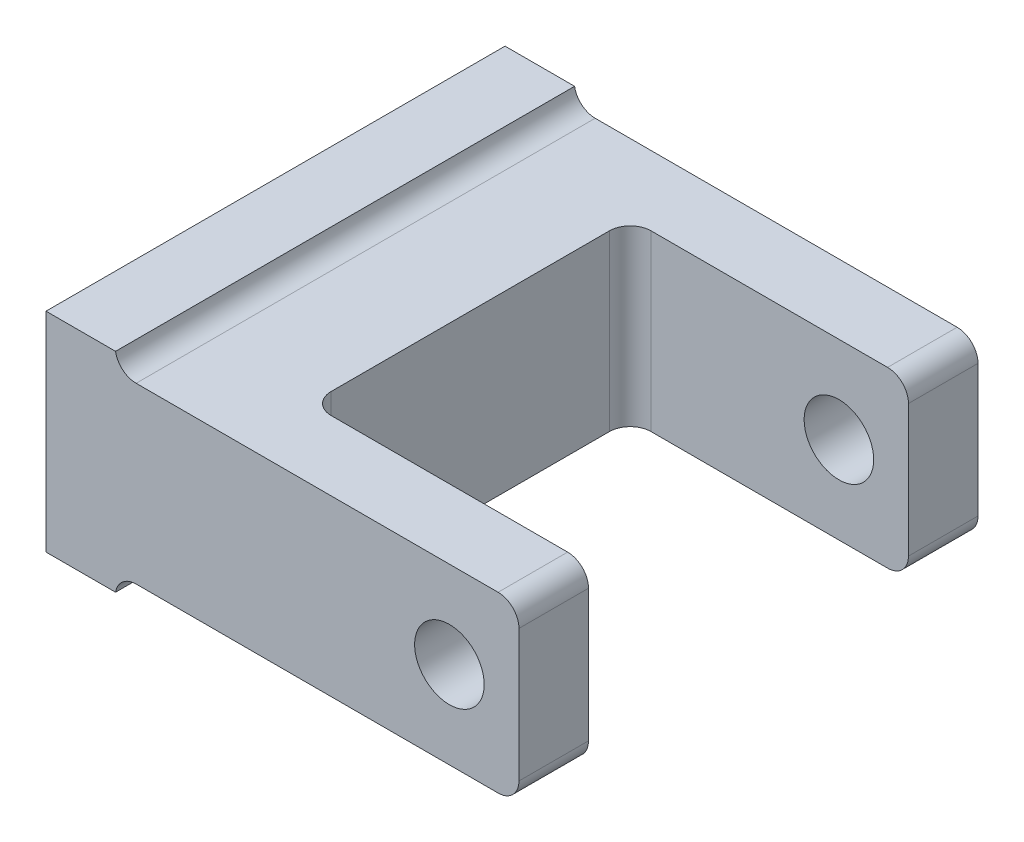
SolidWorks part; units mm, degrees
ref_plane "Front Plane" through (0, 0, 0) normal (0, 0, 1) x (1, 0, 0)
ref_plane "Top Plane" through (0, 0, 0) normal (0, 1, 0) x (1, 0, 0)
ref_plane "Right Plane" through (0, 0, 0) normal (1, 0, 0) x (0, 0, -1)
sketch "Sketch1" plane through (0, 0, 0) normal (0, 0, 1) x (1, 0, 0)
  line L6 (-34, 15) -> (-24, 15)
  line L7 (-24, 15) -> (-24, 12.5)
  line L8 (-24, 12.5) -> (34, 12.5)
  line L9 (34, 12.5) -> (34, -12.5)
  line L10 (34, -12.5) -> (-24, -12.5)
  line L11 (-24, -12.5) -> (-24, -15)
  line L12 (-24, -15) -> (-34, -15)
  line L13 (-34, -15) -> (-34, 15)
  line L14 (34, 0) -> (-34, 0) construction
  point P10 (0, 0)
  dimension "D1" = 25
  dimension "D2" = 30
  dimension "D3" = 58
  dimension "D4" = 10
extrude "Boss-Extrude1" add sketch "Sketch1" along normal blind 66
sketch "Sketch2" plane through (34, 0, 0) normal (1, 0, 0) x (0, 0, -1)
  line L0 (-66, 12.5) -> (0, 12.5) construction
  line L1 (-56, 12.5) -> (-10, 12.5)
  line L2 (-56, 12.5) -> (-56, -12.5)
  line L3 (-56, -12.5) -> (-10, -12.5)
  line L4 (-10, 12.5) -> (-10, -12.5)
  line L5 (-66, -12.5) -> (0, -12.5) construction
  line L6 (-66, -12.5) -> (-66, 12.5) construction
  dimension "D1" = 46
  dimension "D2" = 10
extrude "Cut-Extrude1" cut sketch "Sketch2" against normal blind 40
fillet "Fillet1" radius 3 8 edges at (-24, -12.5, 33) (-24, 12.5, 33) (34, -12.5, 5) (34, -12.5, 61) (34, 12.5, 61) (34, 12.5, 5) (-6, 0, 10) (-6, 0, 56)
sketch "Sketch3" plane through (0, 0, 66) normal (0, 0, 1) x (1, 0, 0)
  line L0 (-21.042, -12.5) -> (31, -12.5) construction
  line L2 (34, -9.5) -> (34, 9.5) construction
  circle A0 centre (24, 0) radius 5
  dimension "D1" = 10
  dimension "D2" = 12.5
  dimension "D3" = 10
extrude "Cut-Extrude2" cut sketch "Sketch3" against normal through all
